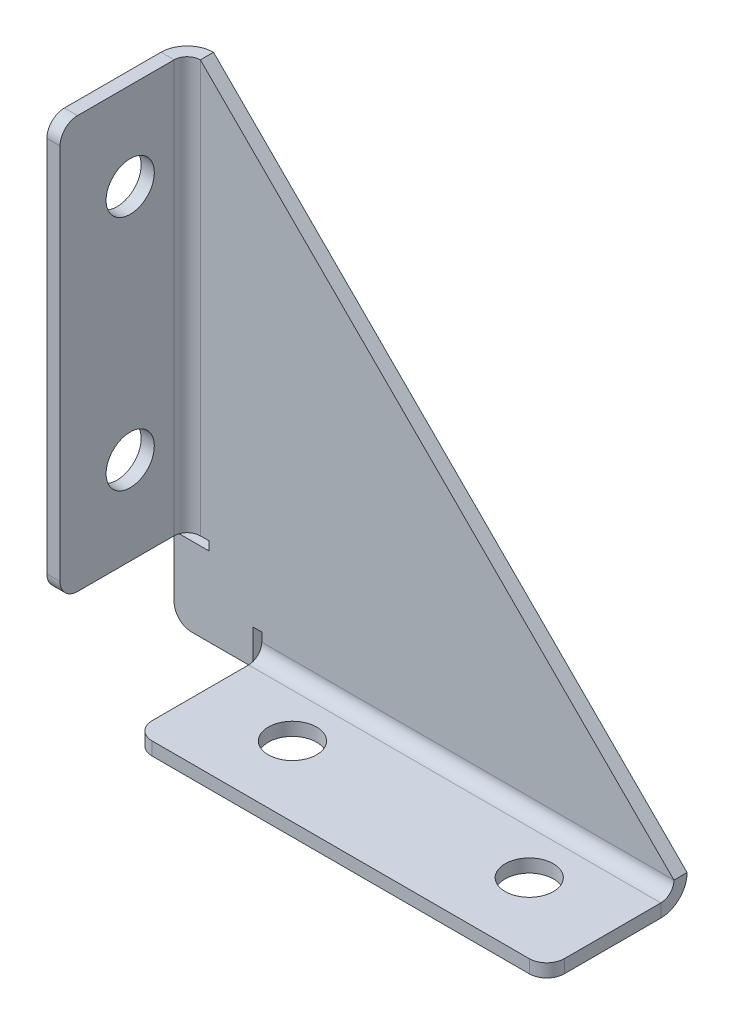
SolidWorks part; units mm, degrees
ref_plane "Plan1" through (0, 0, 0) normal (0, 0, 1) x (1, 0, 0)
ref_plane "Plan2" through (0, 0, 0) normal (0, 1, 0) x (1, 0, 0)
ref_plane "Plan3" through (0, 0, 0) normal (1, 0, 0) x (0, 0, -1)
sketch "Esquisse1" plane through (0, 0, 0) normal (0, 0, 1) x (1, 0, 0)
  line L0 (0, 0) -> (60, 0)
  line L1 (60, 0) -> (0, 60)
  line L2 (0, 60) -> (0, 0)
  dimension "D1" = 60
extrude "Base-Extrusion" add sketch "Esquisse1" along normal blind 1.5
sketch "Esquisse2" plane through (0, 0, 1.5) normal (0, 0, 1) x (1, 0, 0)
  line L0 (0, 57) -> (1.5, 57)
  line L1 (0, 57) -> (0, 10)
  line L2 (1.5, 10) -> (0, 10)
  line L3 (1.5, 10) -> (1.5, 57)
  line L4 (10, 1.5) -> (57, 1.5)
  line L5 (10, 1.5) -> (10, 0)
  line L6 (57, 0) -> (10, 0)
  line L7 (57, 0) -> (57, 1.5)
  line L8 (0, 0) -> (60, 0) construction
  line L9 (0, 60) -> (0, 0) construction
  dimension "D1" = 3
  dimension "D2" = 10
  dimension "D3" = 1.5
  dimension "D4" = 10
extrude "Boss.-Extru.1" add sketch "Esquisse2" along normal blind 14.5
fillet "Congé1" radius 2
sketch "Esquisse3"
  line L0 (-10, 14) -> (-10, 1.5) construction
  line L2 (-12, 16) -> (-55, 16) construction
  circle A0 centre (-47, 8) radius 2.75
  circle A1 centre (-20, 8) radius 2.75
bend "Pli dans angle1" parameters "D1"=0
flatten bends "Dépliage 1" parameters "D1"=1.5
sketch "Esquisse-Angle1" plane through (0, 0, 0) normal (0, 0, -1) x (-1, 0, 0)
  line L0 (-1.2329, 57) -> (-1.2329, 10) construction
  line L1 (-10, 1.2329) -> (-57, 1.2329) construction
bend "Pli dans angle2" bend angle 90 parameters "D1"=0, "D5"=1
sheet metal parameters "Tôlerie 1" parameters "D1"=2, "Epaisseur"=2, "D4"=90, "D5"=2
extrude "Enlèv. mat.-Extru.1" cut sketch "Esquisse3" against normal through all
sketch "Esquisse4" plane through (1.5, 0, 0) normal (1, 0, 0) x (0, 0, -1)
  line L0 (-14, 10) -> (-1.5, 10) construction
  line L1 (-16, 12) -> (-16, 55) construction
  circle A0 centre (-8, 47) radius 2.75
  circle A1 centre (-8, 20) radius 2.75
  dimension "D3" = 5.5
  dimension "D1" = 10
  dimension "D2" = 27
  dimension "D4" = 8
extrude "Enlèv. mat.-Extru.2" cut sketch "Esquisse4" against normal through all
process bends "Pliage 1" parameters "D1"=0
sketch "Esquisse-Plate1" plane through (0, 0, 0) normal (0, 0, -1) x (-1, 0, 0)
